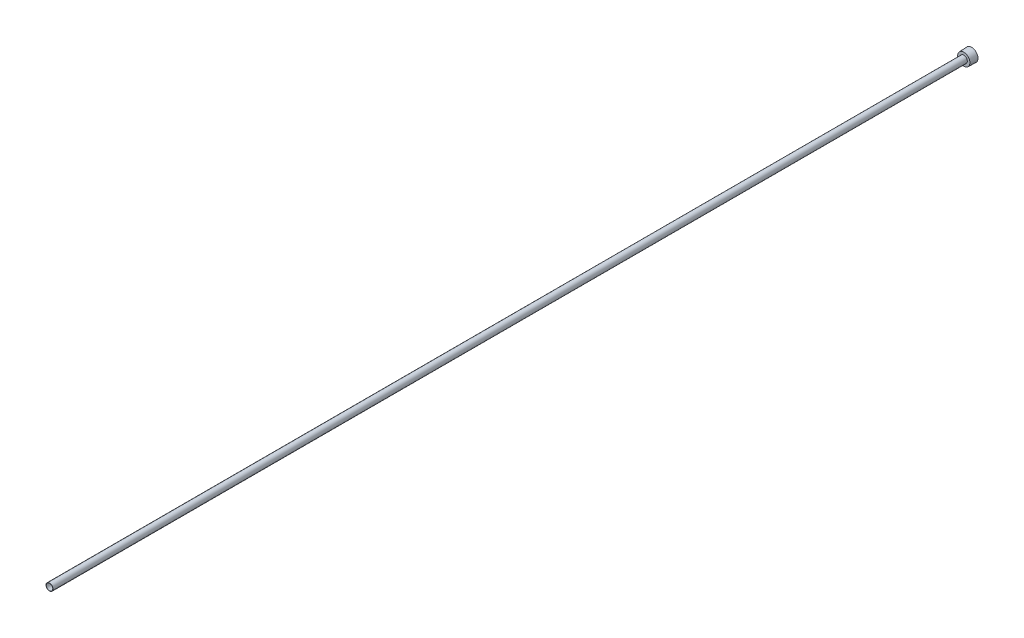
SolidWorks part; units mm, degrees
ref_plane "Front Plane" through (0, 0, 0) normal (0, 0, 1) x (1, 0, 0)
ref_plane "Top Plane" through (0, 0, 0) normal (0, 1, 0) x (1, 0, 0)
ref_plane "Right Plane" through (0, 0, 0) normal (1, 0, 0) x (0, 0, -1)
sketch "Sketch1" plane through (0, 0, 0) normal (1, 0, 0) x (0, 0, -1)
  line L0 (-168.7934, 0) -> (49831.2066, 0) construction
  line L6 (0, 0) -> (0, 8.4709)
  line L7 (0, 8.4709) -> (-10.3124, 8.0947)
  line L8 (-10.3124, 8.0947) -> (-10.3124, 4.6355)
  line L9 (-10.3124, 4.6355) -> (-1219.2, 4.6355)
  line L10 (-1219.2, 4.6355) -> (-1219.2, 0)
  line L11 (0, 0) -> (-1219.2, 0)
  dimension "D1" = 10.3124
  dimension "D2" = 16.9418
  dimension "D3" = 2.089
  dimension "D4" = 9.271
  dimension "D5" = 1219.2
revolve "Revolve1" add sketch "Sketch1" angle 360 about L0
sketch "Sketch2" plane through (0, 0, 1219.2) normal (0, 0, 1) x (1, 0, 0)
  circle A0 centre (0, 0) radius 4.318
  dimension "D1" = 8.636
extrude "Cut-Extrude1" cut sketch "Sketch2" against normal through all
sketch "Sketch3" plane through (0, 0, 0) normal (0, 0, -1) x (-1, 0, 0)
  line L0 (0, 9.318) -> (0, -9.318) construction
  line L1 (-4.7625, -2.7496) -> (0, -5.4993)
  line L2 (0, -5.4993) -> (4.7625, -2.7496)
  line L3 (4.7625, -2.7496) -> (4.7625, 2.7496)
  line L4 (4.7625, 2.7496) -> (0, 5.4993)
  line L5 (0, 5.4993) -> (-4.7625, 2.7496)
  line L6 (-4.7625, 2.7496) -> (-4.7625, -2.7496)
  circle A0 centre (0, 0) radius 4.7625 construction
  dimension "D1" = 9.525
extrude "Cut-Extrude2" cut sketch "Sketch3" against normal blind 6.35
